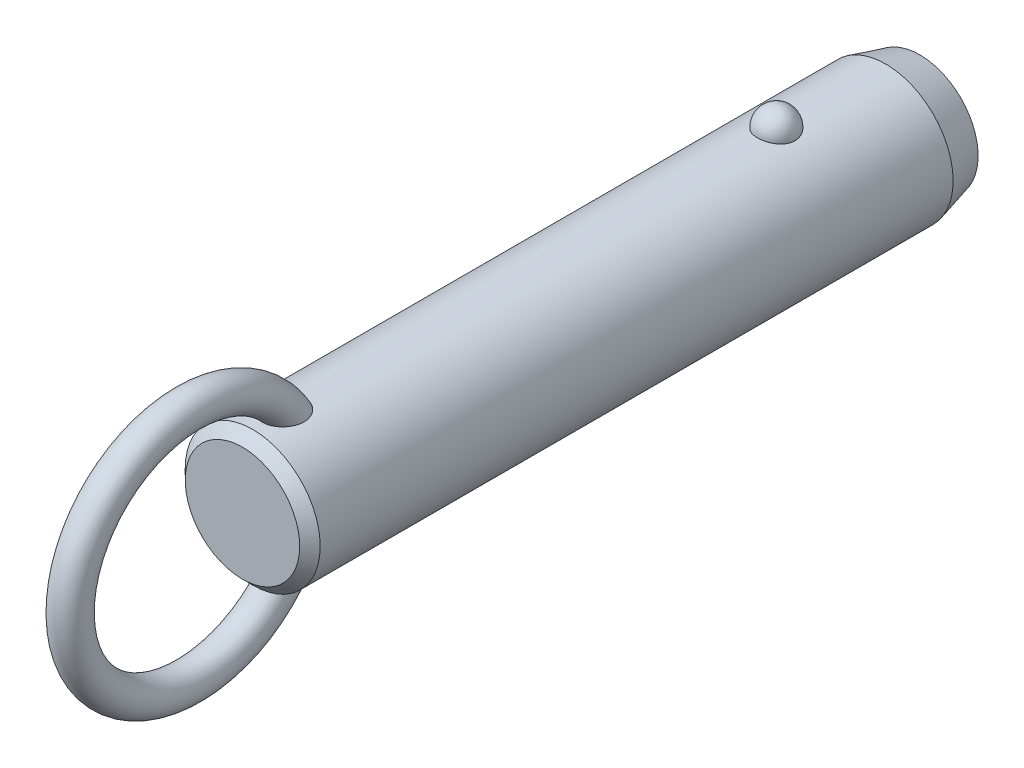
SolidWorks part; units mm, degrees
ref_plane "Front Plane" through (0, 0, 0) normal (0, 0, 1) x (1, 0, 0)
ref_plane "Top Plane" through (0, 0, 0) normal (0, 1, 0) x (1, 0, 0)
ref_plane "Right Plane" through (0, 0, 0) normal (1, 0, 0) x (0, 0, -1)
sketch "Sketch2" plane through (0, 0, 0) normal (0, 0, 1) x (1, 0, 0)
  circle A0 centre (0, 0) radius 7.9
  point P3 (0, 7.9)
  dimension "D1" = 15.8
extrude "Boss-Extrude1" add sketch "Sketch2" along normal blind 50.8
sketch "Sketch3" plane through (0, 0, 0) normal (0, 0, -1) x (-1, 0, 0)
  circle A0 centre (0, 0) radius 7.9
  dimension "D1" = 15.8
extrude "Boss-Extrude2" add sketch "Sketch3" along normal blind 19
chamfer "Chamfer1" distance 4 angle 15 1 edges at (-7.9, 0, -19)
sketch "Sketch12" plane through (0, 0, 0) normal (1, 0, 0) x (0, 0, -1)
  line L0 (-50.8, 7.9) -> (-50.8, -7.9) construction
  point P0 (-50.8, 0)
sketch "Sketch13" plane through (0, 0, 0) normal (1, 0, 0) x (0, 0, -1)
  circle A0 centre (-66.65, 0) radius 15.85
  point P2 (-50.8, 0)
  dimension "D1" = 31.7
sketch "Sketch14" plane through (0, 0, 0) normal (0, 1, 0) x (1, 0, 0)
  circle A0 centre (0, -52.8) radius 2
  point P2 (0, -50.8)
  dimension "D1" = 4
sweep "Sweep1" add profiles "Sketch14" path "Sketch13"
sketch "Sketch15" plane through (0, 0, 50.8) normal (0, 0, 1) x (1, 0, 0)
  circle A0 centre (0, 0) radius 7.9
  dimension "D1" = 15.8
extrude "Boss-Extrude3" add sketch "Sketch15" along normal blind 9.52
chamfer "Chamfer2" distance 1.2 angle 45 1 edges at (7.9, 0, 60.32)
sketch "Sketch18" plane through (0, 0, 0) normal (1, 0, 0) x (0, 0, -1)
  line L0 (15, 7.9) -> (-52.9091, 7.9) construction
  line L1 (2.2, 10.1) -> (2.2, 5.7)
  line L2 (-52.9091, -7.9) -> (15, -7.9) construction
  arc A0 (2.2, 10.1) -> (2.2, 5.7) centre (2.2, 7.9) ccw
  point P4 (0, 7.9)
  dimension "D1" = 18
revolve "Revolve1" add sketch "Sketch18" angle 360 about L1
